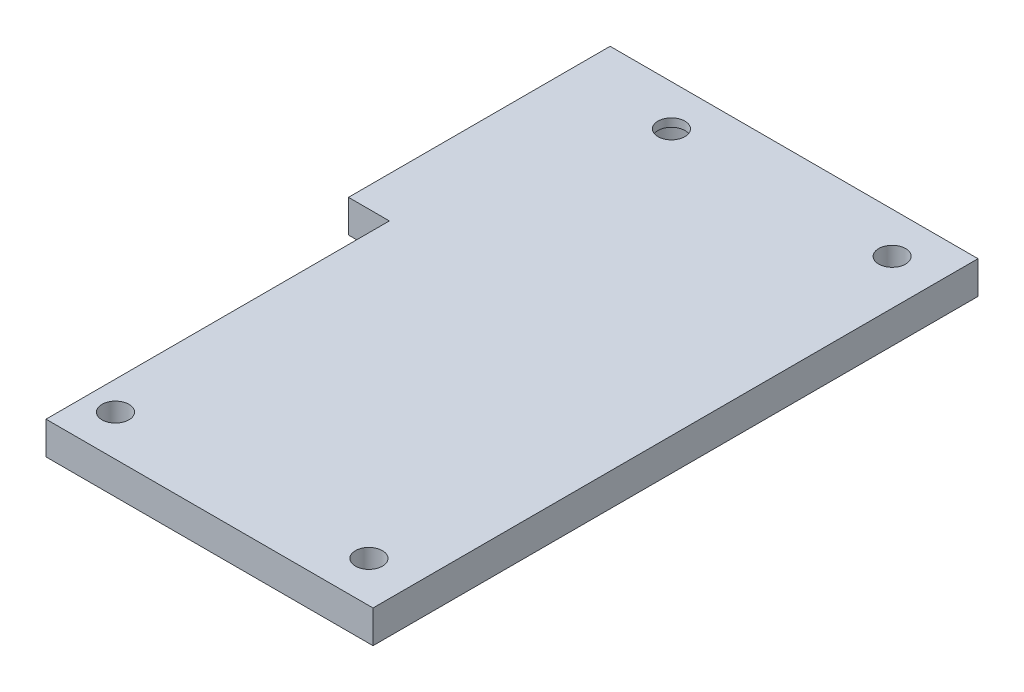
SolidWorks part; units mm, degrees
ref_plane "Спереди" through (0, 0, 0) normal (0, 0, 1) x (1, 0, 0)
ref_plane "Сверху" through (0, 0, 0) normal (0, 1, 0) x (1, 0, 0)
ref_plane "Справа" through (0, 0, 0) normal (1, 0, 0) x (0, 0, -1)
sketch "Sketch1" plane through (0, 0, 0) normal (0, 1, 0) x (1, 0, 0)
  line L0 (-22.5, 32) -> (22.5, 32) construction
  line L1 (22.5, -37) -> (-22.5, -37)
  line L2 (22.5, -37) -> (22.5, 37)
  line L3 (22.5, 37) -> (-22.5, 37)
  line L4 (-22.5, -37) -> (-22.5, 37)
  line L5 (22.5, -37) -> (-22.5, 37) construction
  line L6 (22.5, 37) -> (-22.5, -37) construction
  line L7 (22.5, -32) -> (-22.5, -32) construction
  circle A0 centre (-10, 32) radius 1.65
  circle A1 centre (17, 32) radius 1.65
  circle A2 centre (-14, -32) radius 1.65
  circle A3 centre (17, -32) radius 1.65
  point P0 (0, 0)
  point P18 (0, 32)
  point P19 (0, -32)
  dimension "D5" = 3.3
  dimension "D1" = 45
  dimension "D2" = 74
  dimension "D3" = 5
  dimension "D4" = 5
  dimension "D6" = 17
  dimension "D7" = 10
  dimension "D8" = 17
  dimension "D9" = 14
extrude "Boss-Extrude1" add sketch "Sketch1" along normal blind 4
sketch "Sketch3" plane through (0, 0, 0) normal (0, -1, 0) x (1, 0, 0)
  circle A0 centre (-10, -32) radius 3.75
  dimension "D1" = 7.5
extrude "Cut-Extrude2" cut sketch "Sketch3" against normal blind 3
sketch "Sketch4" plane through (0, 0, 0) normal (0, -1, 0) x (1, 0, 0)
  line L0 (-17.5, 37) -> (-17.5, -5)
  line L1 (-22.5, 37) -> (22.5, 37) construction
  line L2 (-17.5, -5) -> (-22.5, -5)
  line L3 (-22.5, -37) -> (-22.5, 37) construction
  line L4 (-22.5, -5) -> (-22.5, 37)
  line L5 (-22.5, 37) -> (-17.5, 37)
  dimension "D1" = 5
  dimension "D2" = 42
extrude "Cut-Extrude3" cut sketch "Sketch4" against normal through all
